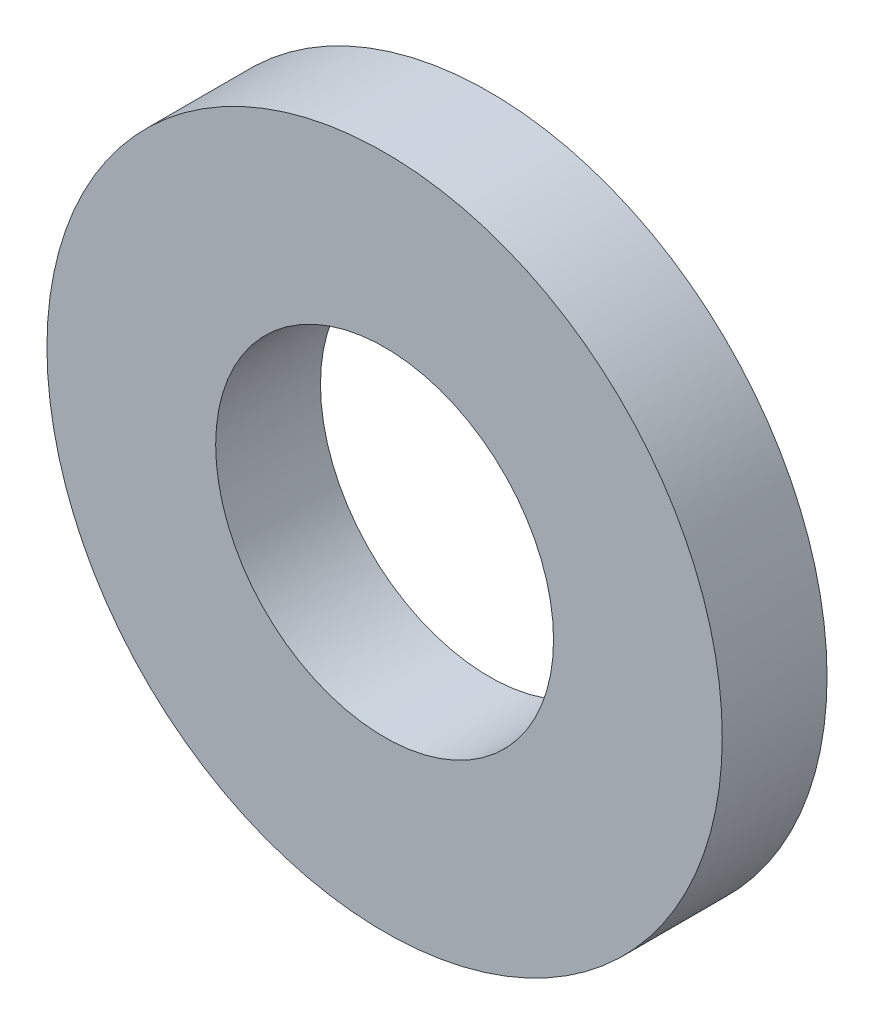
SolidWorks part; units mm, degrees
ref_plane "Front" through (0, 0, 0) normal (0, 0, 1) x (1, 0, 0)
ref_plane "Top" through (0, 0, 0) normal (0, 1, 0) x (1, 0, 0)
ref_plane "Right" through (0, 0, 0) normal (1, 0, 0) x (0, 0, -1)
sketch "Logo3_Revol_Axis" plane through (0, 0, 0) normal (0, 1, 0) x (1, 0, 0)
  line L0 (0, -43.5172) -> (0, 43.5172) construction
sketch "Logo3_bib1" plane through (0, 0, 0) normal (0, -1, 0) x (-1, 0, 0)
  line L0 (5.1594, 0) -> (10.3124, 0)
  line L1 (10.3124, 0) -> (10.3124, 3.2004)
  line L2 (10.3124, 3.2004) -> (5.1594, 3.2004)
  line L3 (5.1594, 3.2004) -> (5.1594, 0)
  line L10 (0, 22.5428) -> (0, -63.2873) construction
  dimension "logo3_d2" = 10.3187
  dimension "logo3_d3" = 20.6248
  dimension "logo3_l1" = 3.2004
revolve "Revolve1" add sketch "Logo3_bib1" angle 360 about L10
